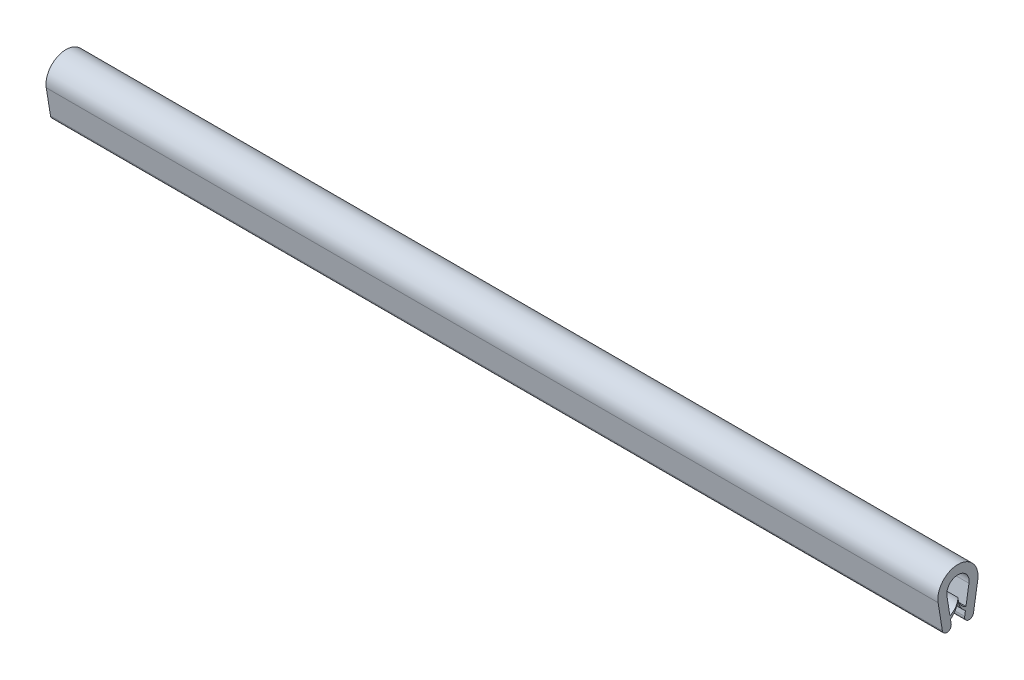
SolidWorks part; units mm, degrees
ref_plane "Front Plane" through (0, 0, 0) normal (0, 0, 1) x (1, 0, 0)
ref_plane "Top Plane" through (0, 0, 0) normal (0, 1, 0) x (1, 0, 0)
ref_plane "Right Plane" through (0, 0, 0) normal (1, 0, 0) x (0, 0, -1)
sketch3d "3DSketch1"
  line L0 (0, 0, 0) -> (200, 0, 0)
  dimension "D1" = 200
other "Reunasuojat 1.6016 REUNASUOJA 1,0-3,0(1)"
ref_plane "Plane1" through (0, 0, 0) normal (1, 0, 0) x (0, 0, -1)
sketch "Sketch1" plane through (0, 0, 0) normal (1, 0, 0) x (0, 0, -1)
  line L0 (-2.7305, 1.1687) -> (-2.0587, -3.0102)
  line L1 (1.5343, -3.0102) -> (2.2061, 1.1687)
  line L2 (-1.7749, -4.7757) -> (-1.9414, -3.7402)
  line L3 (1.4169, -3.7402) -> (1.2505, -4.7757)
  line L4 (3.2251, -5.0932) -> (4.1807, 0.8513)
  line L5 (-4.7052, 0.8513) -> (-3.7495, -5.0932)
  arc A0 (-0.2622, -0.3788) -> (1.5343, -3.0102) centre (2.6956, -0.2883) ccw
  arc A1 (-2.0587, -3.0102) -> (-0.2622, -0.3788) centre (-3.2201, -0.2883) ccw
  arc A2 (-2.7305, 1.9624) -> (-2.7305, 1.1687) centre (-0.2622, 1.5656) ccw
  arc A3 (2.2061, 1.1687) -> (-2.7305, 1.9624) centre (-0.2622, 1.5656) ccw
  arc A4 (-3.7495, -5.0932) -> (-1.7749, -4.7757) centre (-2.7622, -4.9344) ccw
  arc A5 (-1.9414, -3.7402) -> (-0.2622, -0.5788) centre (-4.312, -0.4544) ccw
  arc A6 (-0.2622, -0.5788) -> (1.4169, -3.7402) centre (3.7876, -0.4544) ccw
  arc A7 (1.2505, -4.7757) -> (3.2251, -5.0932) centre (2.2378, -4.9344) ccw
  arc A8 (4.1807, 0.8513) -> (-4.7052, 2.2798) centre (-0.2622, 1.5656) ccw
  arc A9 (-4.7052, 2.2798) -> (-4.7052, 0.8513) centre (-0.2622, 1.5656) ccw
  point P26 (0, 0)
